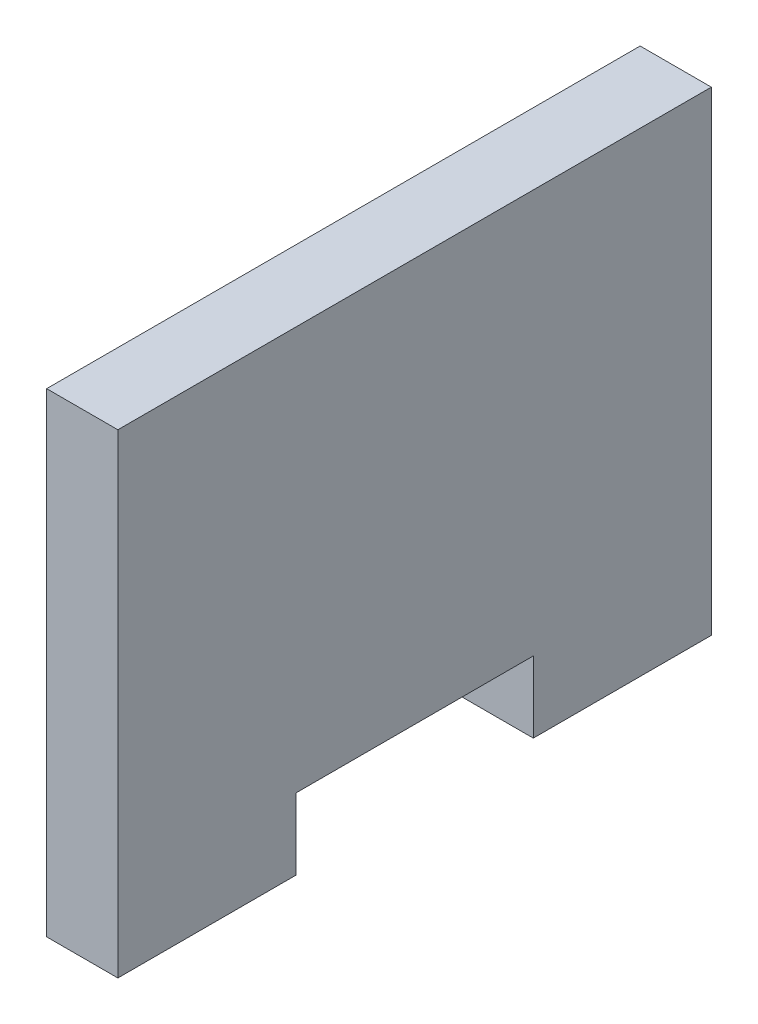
SolidWorks part; units mm, degrees
ref_plane "Front Plane" through (0, 0, 0) normal (0, 0, 1) x (1, 0, 0)
ref_plane "Top Plane" through (0, 0, 0) normal (0, 1, 0) x (1, 0, 0)
ref_plane "Right Plane" through (0, 0, 0) normal (1, 0, 0) x (0, 0, -1)
sketch "Sketch1" plane through (0, 0, 0) normal (1, 0, 0) x (0, 0, -1)
  line L1 (-31.9571, 10.4391) -> (-6.9571, 10.4391)
  line L2 (-31.9571, 10.4391) -> (-31.9571, -9.5609)
  line L3 (-31.9571, -9.5609) -> (-24.4571, -9.5609)
  line L4 (-6.9571, 10.4391) -> (-6.9571, -9.5609)
  line L5 (-14.4571, -9.5609) -> (-6.9571, -9.5609)
  line L7 (-14.4571, -9.5609) -> (-14.4571, -6.5609)
  line L8 (-24.4571, -9.5609) -> (-24.4571, -6.5609)
  line L10 (-24.4571, -6.5609) -> (-14.4571, -6.5609)
extrude "Boss-Extrude1" add sketch "Sketch1" along normal blind 3
